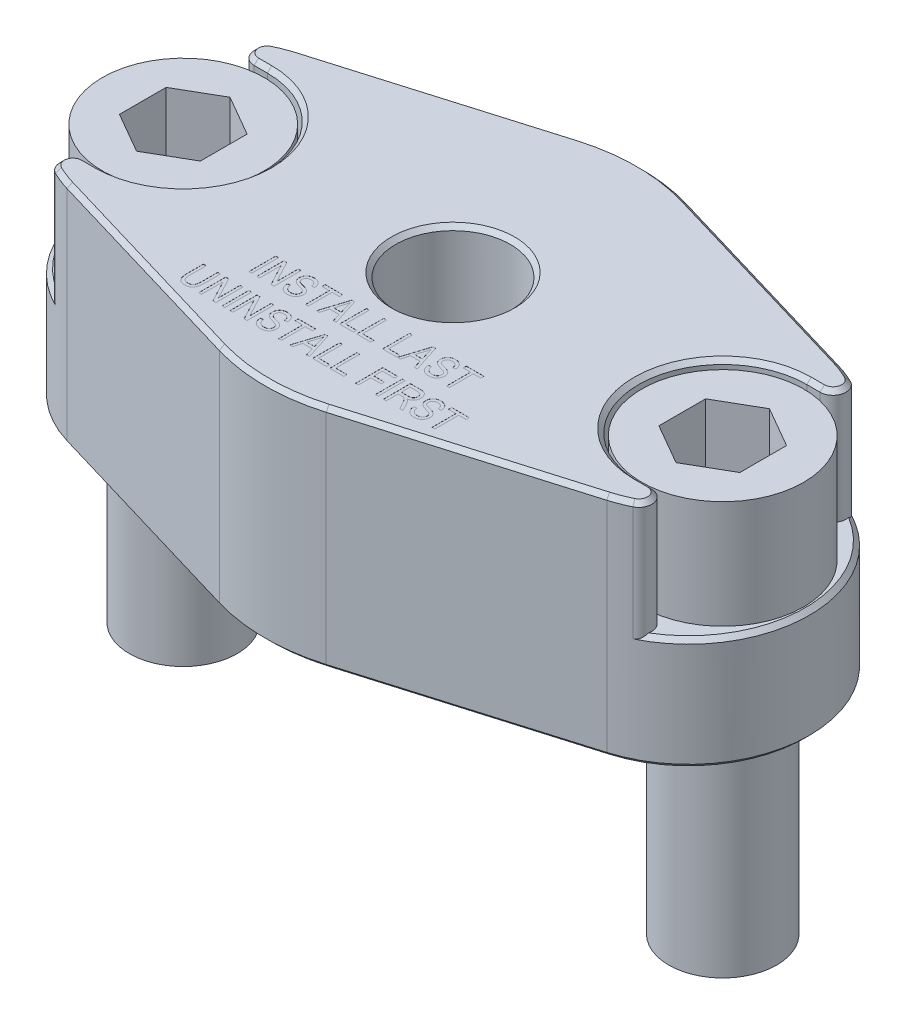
SolidWorks part; units mm, degrees
other "<SHCS50-13L1.50>-<HEX>"
ref_plane "Front Plane" through (0, 0, 0) normal (0, 0, 1) x (1, 0, 0)
ref_plane "Top Plane" through (0, 0, 0) normal (0, 1, 0) x (1, 0, 0)
ref_plane "Right Plane" through (0, 0, 0) normal (1, 0, 0) x (0, 0, -1)
sketch "Sketch1" plane through (0, 0, 0) normal (0, 1, 0) x (1, 0, 0)
  line L0 (-6.2862, 21.2115) -> (-31.7603, 13.6621)
  line L1 (-31.7603, -13.6621) -> (-6.2862, -21.2115)
  line L2 (6.2862, -21.2115) -> (31.7603, -13.6621)
  line L3 (31.7603, 13.6621) -> (6.2862, 21.2115)
  line L4 (-27.7114, 0) -> (27.7114, 0) construction
  line L5 (0, 0) -> (0, 22.9186) construction
  arc A0 (-6.2862, -21.2115) -> (6.2862, -21.2115) centre (0, 0) ccw
  arc A1 (-31.7603, 13.6621) -> (-31.7603, -13.6621) centre (-27.7114, 0) ccw
  arc A2 (31.7603, -13.6621) -> (31.7603, 13.6621) centre (27.7114, 0) ccw
  arc A3 (6.2862, 21.2115) -> (-6.2862, 21.2115) centre (0, 0) ccw
  circle A4 centre (-31.75, 0) radius 6.731
  circle A5 centre (31.75, 0) radius 6.731
  dimension "D1" = 44.2468
  dimension "D2" = 14.2494
  dimension "D3" = 83.9216
  dimension "D5" = 31.75
  dimension "D6" = 13.462
  dimension "D4" = 16.508
extrude "Boss-Extrude1" add sketch "Sketch1" along normal blind 26.7208
sketch "Sketch2" plane through (0, 0, 0) normal (0, -1, 0) x (1, 0, 0)
  circle A0 centre (0, 0) radius 19.177
  dimension "D1" = 38.354
extrude "Cut-Extrude1" cut sketch "Sketch2" against normal blind 12.7
fillet "Fillet1" radius 0.508 1 edges at (0, 12.7, -19.177)
sketch "Sketch3" plane through (0, 26.7208, 0) normal (0, 1, 0) x (1, 0, 0)
  line L0 (-31.75, 9.906) -> (-41.9608, 9.906)
  line L1 (-41.9608, 9.906) -> (-41.9608, -9.906)
  line L2 (-41.9608, -9.906) -> (-31.75, -9.906)
  line L3 (31.75, 9.906) -> (41.9608, 9.906)
  line L4 (41.9608, 9.906) -> (41.9608, -9.906)
  line L5 (41.9608, -9.906) -> (31.75, -9.906)
  arc A0 (-31.75, -9.906) -> (-31.75, 9.906) centre (-31.75, 0) ccw
  arc A1 (31.75, 9.906) -> (31.75, -9.906) centre (31.75, 0) ccw
  arc A2 (-31.7603, 13.6621) -> (-31.7603, -13.6621) centre (-27.7114, 0) ccw construction
  arc A3 (31.7603, -13.6621) -> (31.7603, 13.6621) centre (27.7114, 0) ccw construction
  dimension "D1" = 19.812
extrude "Cut-Extrude2" cut sketch "Sketch3" against normal blind 13.462
hole_wizard "5/8-11 Tapped Hole1" positions "Sketch4" profile "Sketch5" tap size "5/8-11" standard "ANSI Inch"
sketch "Sketch4" plane through (0, 26.7208, 0) normal (0, 1, 0) x (1, 0, 0)
  point P0 (0, 0)
sketch "Sketch5" plane through (0, 26.7208, 0) normal (1, 0, 0) x (0, 0, 1)
  line L0 (0, 0) -> (0, 26.7208)
  line L1 (0, 26.7208) -> (6.7462, 26.7208)
  line L2 (6.7462, 26.7208) -> (6.7462, 0)
  line L5 (6.7462, 0) -> (0, 0)
  line L11 (0, -6.35) -> (0, 107.95) construction
  dimension "Thru Tap Drill Dia." = 13.4925
  dimension "Thru Tap Drill Depth" = 26.7208
fillet "Fillet2" radius 1.524 4 edges at (37.9543, 19.9898, -9.906) (37.9543, 19.9898, 9.906) (-37.9543, 19.9898, 9.906) (-37.9543, 19.9898, -9.906)
chamfer "Chamfer1" distance 0.508 angle 45 34 edges at (19.0232, 26.7208, -17.4368) (32.8857, 26.7208, -13.2767) (32.8857, 26.7208, 13.2767) (19.0232, 26.7208, 17.4368) (0, 26.7208, 22.1234) (-19.0232, 26.7208, 17.4368) (-32.8857, 26.7208, -13.2767) (-32.8857, 26.7208, 13.2767) (-19.0232, 26.7208, -17.4368) (0, 26.7208, -22.1234) (21.844, 26.7208, 0) (-21.844, 26.7208, 0) (0, 26.7208, 6.7462) (31.75, 0, 6.731) (0, 0, -19.177) (-31.75, 0, 6.731) (19.0232, 0, -17.4368) (0, 0, -22.1234) (41.9608, 0, 0) (-19.0232, 0, -17.4368) (19.0232, 0, 17.4368) (-41.9608, 0, 0) (0, 0, 22.1234) (-19.0232, 0, 17.4368) (-32.5276, 26.7208, -9.906) (32.5276, 26.7208, -9.906) (32.5276, 26.7208, 9.906) (-32.5276, 26.7208, 9.906) (34.7899, 26.7208, 11.0862) (-34.7899, 26.7208, 11.0862) (-34.7899, 26.7208, -11.0862) (34.7899, 26.7208, -11.0862) (41.9608, 13.2588, 0) (-41.9608, 13.2588, 0)
sketch "Sketch6" plane through (0, 26.7208, 0) normal (0, 1, 0) x (1, 0, 0)
  line L0 (-19.05, -11.938) -> (19.05, -11.938) construction
  line L1 (0, 21.6154) -> (0, -22.1234) construction
  line L3 (-19.05, -17.018) -> (19.05, -17.018) construction
  arc A0 (6.1419, 20.7245) -> (-6.1419, 20.7245) centre (0, 0) ccw construction
  arc A1 (-6.2862, -21.2115) -> (6.2862, -21.2115) centre (0, 0) ccw construction
  text T0 "INSTALL LAST" font "Arial Narrow" height 3.175
  text T2 "UNINSTALL FIRST" font "Arial Narrow" height 3.175
  point P14 (0, -11.938)
  dimension "D2" = 38.1
  dimension "D4" = 11.938
  dimension "D5" = 5.08
extrude "Cut-Extrude3" cut sketch "Sketch6" against normal blind 0.0127
inserted part "SHCS50-13L1.50"
move or copy body "Body-Move/Copy2" placed by mates yes parameters "D1"=0, "D2"=0, "D3"=0
mirror "Mirror1" about plane through (0, 0, 0) normal (1, 0, 0)
